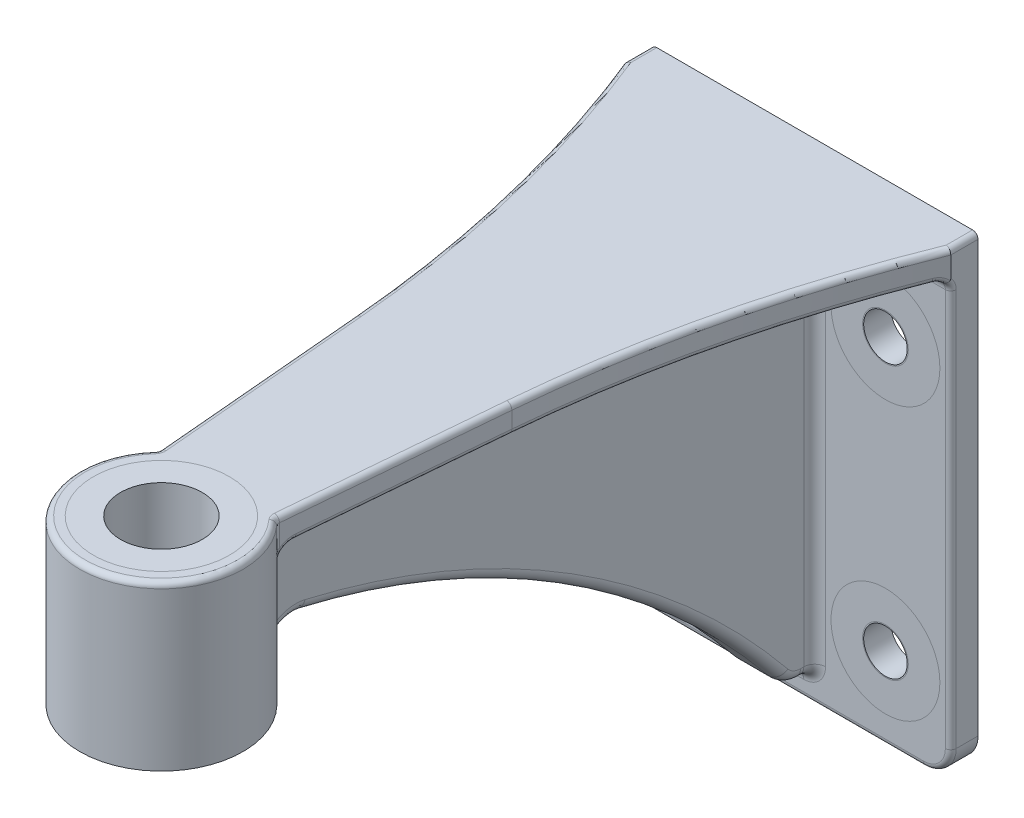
SolidWorks part; units mm, degrees
ref_plane "Front Plane" through (0, 0, 0) normal (0, 0, 1) x (1, 0, 0)
ref_plane "Top Plane" through (0, 0, 0) normal (0, 1, 0) x (1, 0, 0)
ref_plane "Right Plane" through (0, 0, 0) normal (1, 0, 0) x (0, 0, -1)
sketch "Sketch2" plane through (0, 0, 0) normal (0, 0, 1) x (1, 0, 0)
  line L1 (0, 0) -> (38.1, 0)
  line L2 (0, 0) -> (0, -107.95)
  line L3 (0, -107.95) -> (38.1, -107.95)
  line L4 (38.1, 0) -> (38.1, -107.95)
  dimension "D1" = 107.95
  dimension "D2" = 38.1
sketch "Sketch3" plane through (0, 0, 0) normal (1, 0, 0) x (0, 0, -1)
  line L0 (0, 0) -> (0, -101.6)
  line L1 (0, 0) -> (0, -107.95) construction
  line L2 (0, 0) -> (0, -107.95) construction
  line L3 (0, -101.6) -> (-12.7, -101.6)
  line L4 (0, 0) -> (-152.4, 0)
  line L5 (-152.4, 0) -> (-152.4, -25.4)
  arc A0 (-152.4, -25.4) -> (-12.7, -101.6) centre (-172.0833, -227.6444) cw
  dimension "D4" = 203.2
  dimension "D1" = 25.4
  dimension "D2" = 12.7
  dimension "D3" = 152.4
  dimension "D5" = 101.6
extrude "Boss-Extrude2" add sketch "Sketch3" along normal blind 6.35
extrude "Boss-Extrude3" add sketch "Sketch2" along normal blind 6.35
sketch "Sketch4" plane through (0, 0, 0) normal (0, 1, 0) x (1, 0, 0)
  line L0 (0, 0) -> (38.1, 0)
  line L1 (38.1, 0) -> (38.1, -6.35)
  line L2 (0, 0) -> (0, -152.4)
  line L3 (0, -152.4) -> (12.7, -152.4)
  line L4 (12.7, -152.4) -> (18.2555, -88.9)
  line L5 (18.2555, -88.9) -> (6.35, -88.9) construction
  line L6 (6.35, -6.35) -> (6.35, -152.4) construction
  arc A0 (18.2555, -88.9) -> (38.1, -6.35) centre (303.7945, -113.8814) cw
  dimension "D1" = 12.7
  dimension "D2" = 63.5
  dimension "D3" = 5
extrude "Boss-Extrude4" add sketch "Sketch4" against normal blind 6.35
sketch "Sketch5" plane through (0, 0, 6.35) normal (0, 0, 1) x (1, 0, 0)
  line L0 (22.86, -25.4) -> (22.86, -88.9) construction
  line L1 (0, -107.95) -> (38.1, -107.95) construction
  line L2 (6.35, -6.35) -> (38.1, -6.35) construction
  line L3 (38.1, -107.95) -> (38.1, -6.35) construction
  circle A0 centre (22.86, -25.4) radius 5.08
  circle A1 centre (22.86, -88.9) radius 5.08
  dimension "D4" = 10.16
  dimension "D1" = 19.05
  dimension "D2" = 19.05
  dimension "D3" = 15.24
extrude "Cut-Extrude1" cut sketch "Sketch5" against normal up to next
mirror "Mirror1" about plane through (0, -227.6444, 172.0833) normal (-1, 0, 0)
sketch "Sketch6" plane through (0, 0, 0) normal (0, 1, 0) x (1, 0, 0)
  line L0 (12.7, -152.4) -> (-12.7, -152.4) construction
  circle A0 centre (0, -152.4) radius 19.05
  dimension "D1" = 38.1
extrude "Boss-Extrude5" add sketch "Sketch6" against normal blind 38.1
sketch "Sketch7" plane through (0, 0, 0) normal (0, 1, 0) x (1, 0, 0)
  circle A0 centre (0, -152.4) radius 9.525
  dimension "D1" = 19.05
extrude "Cut-Extrude2" cut sketch "Sketch7" against normal up to next
fillet "Fillet1" radius 6.35 4 edges at (1.9825, -28.1501, 133.4534) (0, -101.6, 12.7) (38.1, -107.95, 3.175) (-38.1, -107.95, 3.175)
fillet "Fillet2" radius 2.54 19 edges at (6.35, -30.5702, 131.6146) (6.35, -101.6, 8.0026) (6.35, -100.9858, 12.3797) (22.225, -6.35, 6.35) (6.35, -6.35, 70.3947) (6.35, -21.0203, 134.4395) (6.35, -55.1477, 64.6817) (6.35, -53.975, 6.35) (-6.35, -53.975, 6.35) (-6.35, -101.6, 8.0026) (-6.35, -31.4852, 132.7233) (-6.35, -55.1477, 64.6817) (10.3875, -6.35, 136.4312) (-10.3875, -6.35, 136.4312) (-6.35, -21.0203, 134.4395) (-6.35, -6.35, 70.3947) (-22.225, -6.35, 6.35) (-6.35, -100.9858, 12.3797) (0, -101.6, 6.35)
fillet "Fillet3" radius 1.27 22 edges at (-25.1043, 0, 46.8862) (-16.0502, 0, 114.1074) (0, 0, 171.45) (16.0502, 0, 114.1074) (-38.1, 0, 3.175) (-13.8448, -4.445, 139.3148) (13.8448, -4.445, 139.3148) (38.1, 0, 3.175) (25.1043, 0, 46.8862) (13.8865, -7.5867, 138.8387) (16.1919, -6.35, 112.4873) (37.7541, -6.9862, 7.2086) (-13.9179, -7.2099, 138.479) (38.1, -55.245, 6.35) (36.2401, -106.0901, 6.35) (0, -107.95, 6.35) (-36.2401, -106.0901, 6.35) (-38.1, -55.245, 6.35) (-37.902, -7.3895, 6.8406) (-24.7879, -6.35, 48.2165) (24.7879, -6.35, 48.2165) (-16.1919, -6.35, 112.4873)
sketch "Sketch8" plane through (0, 0, 6.35) normal (0, 0, 1) x (1, 0, 0)
  circle A0 centre (22.86, -25.4) radius 12.7
  circle A1 centre (22.86, -25.4) radius 5.334
  circle A2 centre (22.86, -88.9) radius 12.7
  circle A3 centre (22.86, -88.9) radius 5.334
  circle A4 centre (-22.86, -88.9) radius 12.7
  circle A5 centre (-22.86, -88.9) radius 5.334
  circle A6 centre (-22.86, -25.4) radius 12.7
  circle A7 centre (-22.86, -25.4) radius 5.334
  dimension "D1" = 10.668
  dimension "D2" = 25.4
sketch "Sketch9" plane through (6.35, 0, 0) normal (1, 0, 0) x (0, 0, -1)
  line L8 (-17.78, -69.4589) -> (-17.78, -17.78)
  line L9 (-17.78, -17.78) -> (-102.8801, -17.78)
  line L10 (-17.78, -69.4589) -> (-17.78, -17.78)
  line L11 (-17.78, -17.78) -> (-102.8801, -17.78)
  arc A2 (-17.78, -69.4589) -> (-102.8801, -17.78) centre (-172.0833, -227.6444) ccw
  arc A3 (-17.78, -69.4589) -> (-102.8801, -17.78) centre (-172.0833, -227.6444) ccw
  dimension "D1" = 17.78
extrude "Cut-Extrude3" [suppressed] cut sketch "Sketch9" against normal through all
fillet "Fillet6" [suppressed] radius 6.35
fillet "Fillet4" [suppressed] radius 3.81
fillet "Fillet5" [suppressed] radius 1.27
sketch "Sketch13" plane through (0, 0, 0) normal (0, 1, 0) x (1, 0, 0)
  circle A0 centre (0, -152.4) radius 15.875
  dimension "D1" = 31.75
